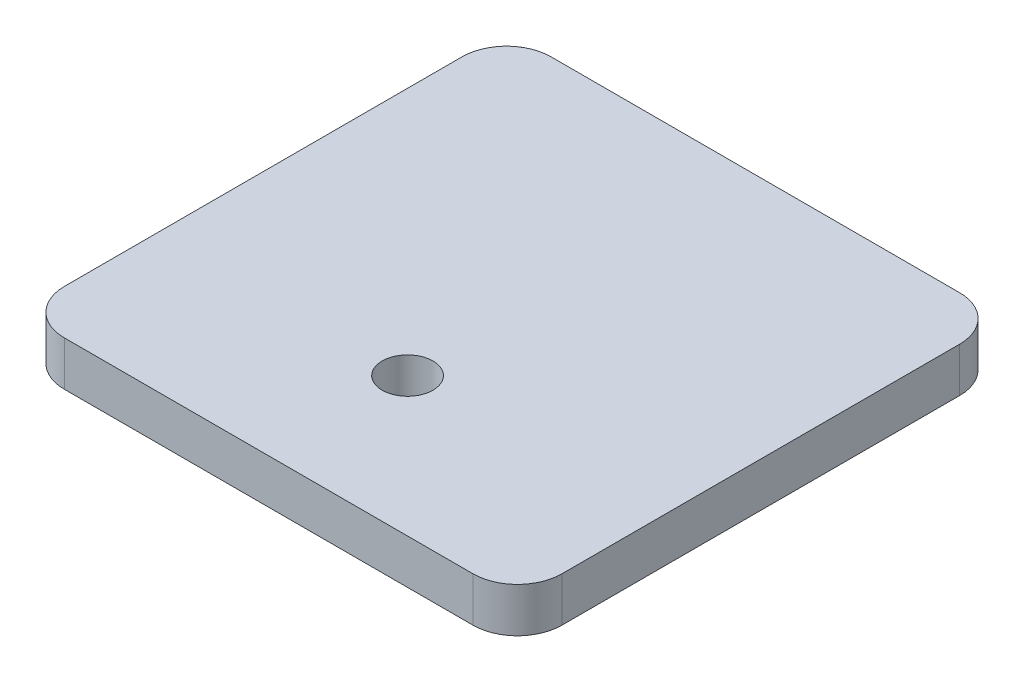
SolidWorks part; units mm, degrees
ref_plane "Face" through (0, 0, 0) normal (0, 0, 1) x (1, 0, 0)
ref_plane "Dessus" through (0, 0, 0) normal (0, 1, 0) x (1, 0, 0)
ref_plane "Droite" through (0, 0, 0) normal (1, 0, 0) x (0, 0, -1)
sketch "Esquisse1" plane through (0, 0, 0) normal (0, 1, 0) x (1, 0, 0)
  line L0 (55.875, -23.9565) -> (55.875, 82.6177) construction
  line L1 (10, 0) -> (101.75, 0)
  line L2 (0, 10) -> (0, 99.3)
  line L3 (10, 109.3) -> (101.75, 109.3)
  line L4 (111.75, 10) -> (111.75, 99.3)
  line L5 (-11.2231, 31.2) -> (62.2184, 31.2) construction
  line L6 (124.8808, 0) -> (-11.2231, 0) construction
  arc A0 (101.75, 0) -> (111.75, 10) centre (101.75, 10) ccw
  arc A1 (101.75, 109.3) -> (111.75, 99.3) centre (101.75, 99.3) cw
  arc A2 (0, 99.3) -> (10, 109.3) centre (10, 99.3) cw
  arc A3 (10, 0) -> (0, 10) centre (10, 10) cw
  circle A4 centre (55.875, 31.2) radius 5.7
  point P12 (0, 0)
  dimension "D1" = 10
  dimension "D2" = 31.2
extrude "Extrusion1" add sketch "Esquisse1" along normal blind 10
sketch "Esquisse2" plane through (0, 0, 0) normal (0, -1, 0) x (1, 0, 0)
  line L0 (-10.92, 0) -> (121.998, 0) construction
  line L1 (0, 4.0185) -> (0, -110.2185) construction
  line L2 (-6.6265, -13.1) -> (121.998, -13.1) construction
  line L3 (13.1, 4.0185) -> (13.1, -110.2185) construction
  line L4 (98.65, 4.0185) -> (98.65, -79.8449) construction
  line L5 (-6.6265, -109.3) -> (121.998, -109.3) construction
  line L6 (111.75, -110.2185) -> (111.75, 4.0185) construction
  line L7 (92.9638, -42.65) -> (117.9644, -42.65) construction
  line L8 (-6.6265, -96.2) -> (86.1091, -96.2) construction
  line L9 (10, 7.7627) -> (10, -110.2185) construction
  line L10 (16.2, 7.7627) -> (16.2, -110.2185) construction
  line L11 (-10.92, -16.2) -> (121.998, -16.2) construction
  line L12 (-10.92, -10) -> (121.998, -10) construction
  line L13 (101.75, 7.7627) -> (101.75, -59.7501) construction
  line L14 (95.55, 7.7627) -> (95.55, -59.7501) construction
  line L15 (101.75, -10) -> (80.0214, -31.7286) construction
  line L16 (101.75, -42.65) -> (93.9532, -34.8532) construction
  line L17 (33.7131, -33.7131) -> (10, -10) construction
  line L18 (12.2627, -96.2) -> (13.9373, -96.2)
  line L19 (22.783, -83.417) -> (10, -96.2) construction
  line L20 (97.8127, -42.65) -> (99.4873, -42.65)
  line L21 (16.2, -93.9373) -> (16.2, -16.2)
  line L22 (16.2, -16.2) -> (95.55, -16.2)
  line L23 (95.55, -16.2) -> (95.55, -40.3873)
  line L24 (101.75, -40.3873) -> (101.75, -12.2627)
  line L25 (99.4873, -10) -> (12.39, -10)
  line L26 (10, -12.39) -> (10, -93.9373)
  line L27 (55.9386, 7.7627) -> (55.9386, -107.2504) construction
  line L28 (46.6465, -59.744) -> (71.0883, -59.744) construction
  line L29 (66.9386, -33.7131) -> (66.9386, -107.2504) construction
  line L30 (38.0742, -36.744) -> (71.0883, -36.744) construction
  arc A0 (99.4873, -42.65) -> (101.75, -40.3873) centre (100.6186, -41.5186) ccw
  arc A1 (101.75, -12.2627) -> (99.4873, -10) centre (100.6186, -11.1314) ccw
  arc A2 (12.39, -10) -> (10, -12.39) centre (11.195, -11.195) ccw
  arc A3 (10, -93.9373) -> (12.2627, -96.2) centre (11.1314, -95.0686) ccw
  arc A4 (97.8127, -42.65) -> (95.55, -40.3873) centre (96.6814, -41.5186) cw
  arc A5 (16.2, -93.9373) -> (13.9373, -96.2) centre (15.0686, -95.0686) cw
  circle A6 centre (66.9386, -36.744) radius 1.1
  circle A7 centre (44.9386, -36.744) radius 1.1
  circle A8 centre (44.9386, -82.744) radius 1.1
  circle A9 centre (66.9386, -82.744) radius 1.1
  dimension "D16" = 11
  dimension "D1" = 13.1
  dimension "D2" = 13.1
  dimension "D3" = 13.1
  dimension "D4" = 13.1
  dimension "D5" = 29.55
  dimension "D6" = 6.2
  dimension "D7" = 3.1
  dimension "D8" = 6.2
  dimension "D9" = 3.1
  dimension "D10" = 6.2
  dimension "D11" = 3.1
  dimension "D12" = 45
  dimension "D13" = 45
  dimension "D14" = 45
  dimension "D15" = 45
  dimension "D17" = 23
extrude "Enlèv. mat.-Extru.1" cut sketch "Esquisse2" against normal blind 3
sketch "Esquisse3" plane through (0, 0, 0) normal (0, -1, 0) x (1, 0, 0)
  line L0 (55.875, 10.4482) -> (55.875, -33.8351) construction
  line L1 (121.7604, -10) -> (63.7878, -10) construction
  line L2 (99.4873, -10) -> (12.39, -10) construction
  line L3 (121.7604, -13.1) -> (48.2792, -13.1) construction
  line L4 (-5.8407, -96.2) -> (91.6389, -96.2) construction
  line L5 (-5.8407, -56.2) -> (19.9176, -56.2) construction
  line L6 (13.1, -106.9527) -> (13.1, -33.8351) construction
  line L7 (10, -75.1645) -> (10, -106.9527) construction
  line L8 (10, -12.39) -> (10, -93.9373) construction
  circle A0 centre (55.875, -13.1) radius 4
  circle A1 centre (13.1, -56.2) radius 4
  dimension "D2" = 40
  dimension "D1" = 3.1
  dimension "D3" = 3.1
extrude "Enlèv. mat.-Extru.2" cut sketch "Esquisse3" against normal blind 8.2
